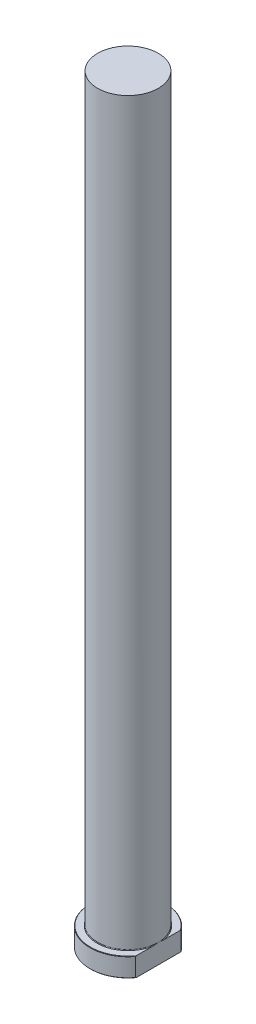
SolidWorks part; units mm, degrees
ref_plane "Front Plane" through (0, 0, 0) normal (0, 0, 1) x (1, 0, 0)
ref_plane "Top Plane" through (0, 0, 0) normal (0, 1, 0) x (1, 0, 0)
ref_plane "Right Plane" through (0, 0, 0) normal (1, 0, 0) x (0, 0, -1)
sketch "Sketch1" plane through (0, 0, 0) normal (0, 0, 1) x (1, 0, 0)
  line L0 (0, 259.9588) -> (0, -15.1925) construction
  line L1 (0, 0) -> (-20, 0)
  line L2 (-20, 0) -> (-20, 10)
  line L3 (-20, 10) -> (-16, 10)
  line L4 (-16, 10) -> (-16, 400)
  line L5 (-16, 400) -> (0, 400)
  line L6 (0, 400) -> (0, 0)
  dimension "L" = 400
  dimension "H" = 40
  dimension "T" = 10
  dimension "D" = 32
revolve "Revolve1" add sketch "Sketch1" angle 360 about L0
chamfer "Chamfer1" distance 0.2 angle 45 2 edges at (0, 10, 20) (0, 0, 20)
fillet "Fillet1" radius 0.3 1 edges at (0, 10, 16)
sketch "Sketch2" plane through (0, 0, 0) normal (0, 1, 0) x (1, 0, 0)
  line L0 (16, 12) -> (16, -12)
  circle A0 centre (0, 0) radius 20 construction
  arc A1 (16, -12) -> (16, 12) centre (0, 0) ccw
  circle A2 centre (0, 0) radius 16 construction
extrude "KEY" cut sketch "Sketch2" along normal through all
